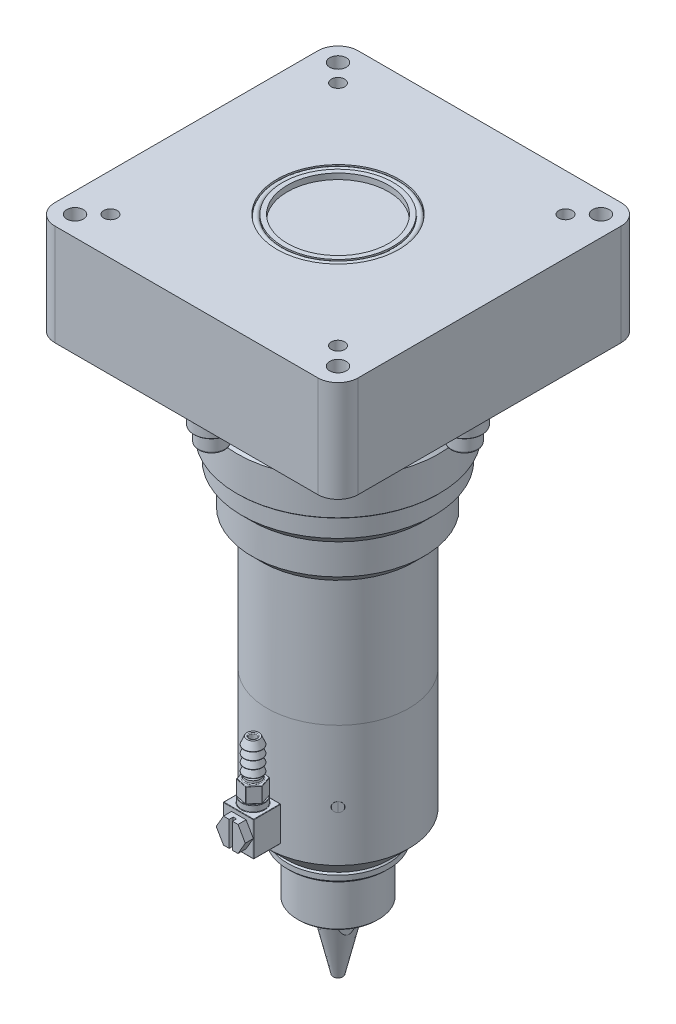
SolidWorks part; units mm, degrees
ref_plane "Front Plane" through (0, 0, 0) normal (0, 0, 1) x (1, 0, 0)
ref_plane "Top Plane" through (0, 0, 0) normal (0, 1, 0) x (1, 0, 0)
ref_plane "Right Plane" through (0, 0, 0) normal (1, 0, 0) x (0, 0, -1)
imported_body "Defeatured3"
hole_wizard "CBORE for M5 SHCS1" positions "Sketch1" profile "Sketch2" counterbore size "M5" standard "HAAS"
sketch "Sketch1" plane through (0, 0, 0) normal (0, -1, 0) x (-1, 0, 0)
  line L0 (0, 0) -> (-51.7471, 0) construction
  line L2 (0, 0) -> (0, -63.6074) construction
  point P0 (41.275, 41.275)
  point P13 (41.275, -41.275)
  point P14 (-41.275, -41.275)
  point P15 (-41.275, 41.275)
  dimension "D1" = 41.275
  dimension "D2" = 41.275
sketch "Sketch2" plane through (-41.275, 0, -41.275) normal (1, 0, 0) x (0, 0, -1)
  line L0 (0, 0) -> (0, 5.335)
  line L1 (0, 5.335) -> (2.6035, 5.335)
  line L3 (2.6035, 5.335) -> (2.6035, 5.334)
  line L4 (2.6035, 5.334) -> (4.3561, 5.334)
  line L5 (4.3561, 5.334) -> (4.3561, 0)
  line L7 (4.3561, 0) -> (0, 0)
  line L11 (0, -6.35) -> (0, 107.95) construction
  dimension "Thru Hole Dia." = 5.207
  dimension "Thru Hole Depth" = 5.334
  dimension "C'Bore Dia." = 8.7122
